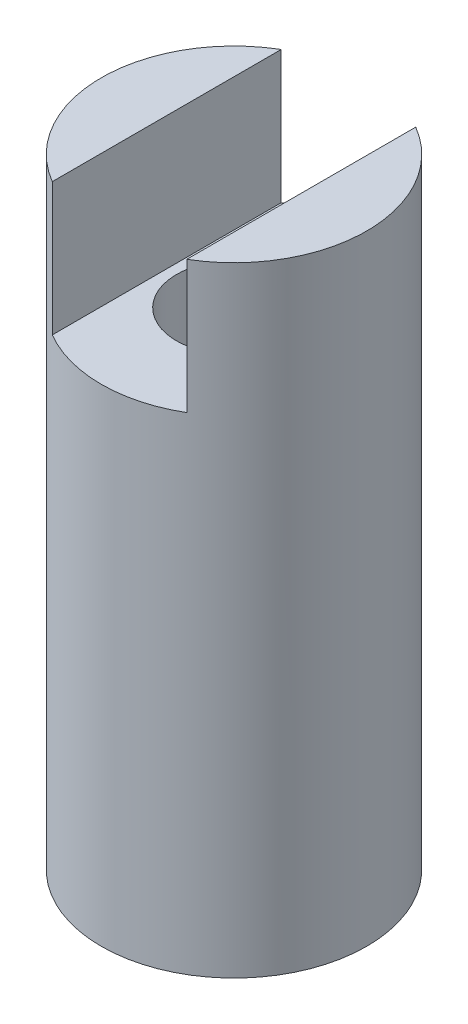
SolidWorks part; units mm, degrees
ref_plane "Plan de face" through (0, 0, 0) normal (0, 0, 1) x (1, 0, 0)
ref_plane "Plan de dessus" through (0, 0, 0) normal (0, 1, 0) x (1, 0, 0)
ref_plane "Plan de droite" through (0, 0, 0) normal (1, 0, 0) x (0, 0, -1)
sketch "Esquisse1" plane through (0, 0, 0) normal (0, 0, 1) x (1, 0, 0)
  line L0 (-3.25, 0) -> (-15, 0)
  line L1 (-15, 0) -> (-15, 70)
  line L2 (-15, 70) -> (-6.5, 70)
  line L3 (-6.5, 70) -> (-6.5, 45)
  line L4 (-6.5, 45) -> (-3.25, 41.75)
  line L5 (-3.25, 41.75) -> (-3.25, 0)
  line L6 (0, 0) -> (0, 31.6233) construction
  dimension "D1" = 30
  dimension "D2" = 6.5
  dimension "D3" = 70
  dimension "D4" = 45
  dimension "D5" = 13
  dimension "D6" = 45
revolve "Révolution1" add sketch "Esquisse1" angle 360 about L6
sketch "Esquisse2" plane through (0, 0, 0) normal (1, 0, 0) x (0, 0, -1)
  line L1 (-25, 55) -> (25, 55)
  line L2 (-25, 55) -> (-25, 85)
  line L3 (-25, 85) -> (25, 85)
  line L4 (25, 55) -> (25, 85)
  line L5 (-15, 0) -> (15, 0) construction
  line L6 (15, 0) -> (15, 70) construction
  dimension "D1" = 50
  dimension "D2" = 30
  dimension "D3" = 55
  dimension "D4" = 10
extrude "Enlèv. mat.-Extru.1" cut sketch "Esquisse2" against normal mid plane 15.2
